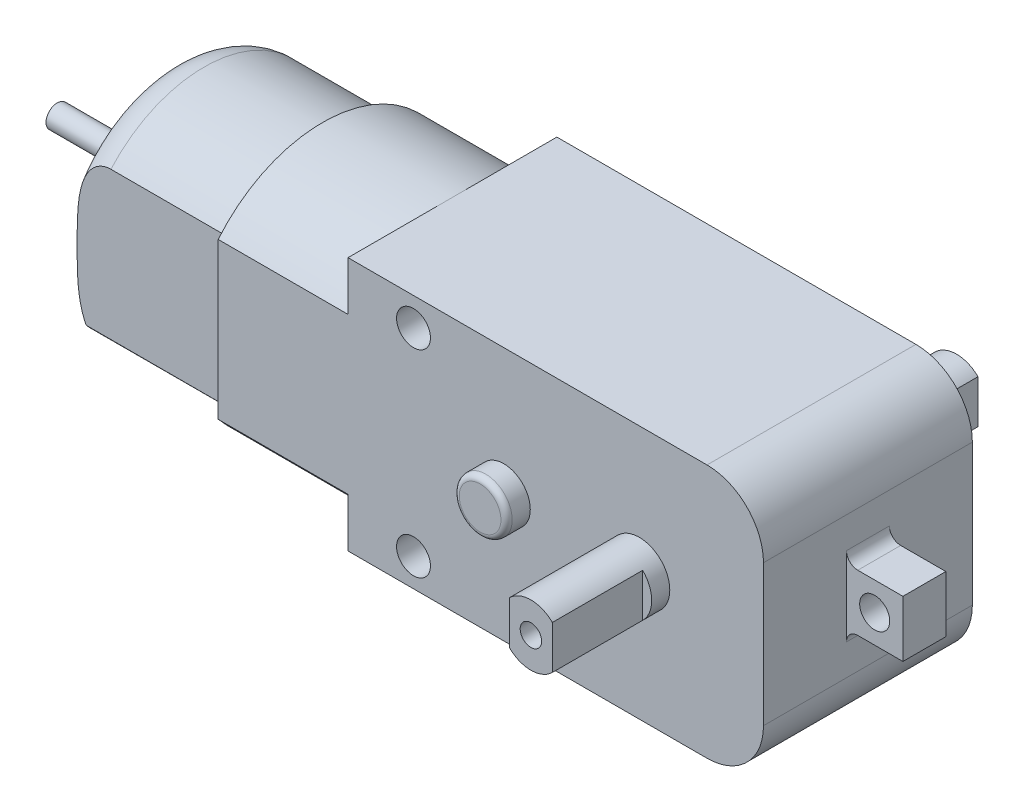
SolidWorks part; units mm, degrees
ref_plane "Plan de face" through (0, 0, 0) normal (0, 0, 1) x (1, 0, 0)
ref_plane "Plan de dessus" through (0, 0, 0) normal (0, 1, 0) x (1, 0, 0)
ref_plane "Plan de droite" through (0, 0, 0) normal (1, 0, 0) x (0, 0, -1)
sketch "Esquisse1" plane through (0, 0, 0) normal (0, 0, 1) x (1, 0, 0)
  line L0 (0, 0) -> (-18.8699, 0) construction
  line L1 (0, 11.25) -> (36.8, 11.25)
  line L2 (0, 11.25) -> (0, -11.25)
  line L3 (0, -11.25) -> (36.8, -11.25)
  line L4 (36.8, 11.25) -> (36.8, -11.25)
  dimension "D1" = 22.5
  dimension "D2" = 36.8
extrude "Boss.-Extru.1" add sketch "Esquisse1" along normal mid plane 18.5
fillet "Congé1" radius 5 2 edges at (36.8, -11.25, 0) (36.8, 11.25, 0)
sketch "Esquisse2" plane through (0, 0, 0) normal (-1, 0, 0) x (0, 0, 1)
  line L0 (-9.25, -6.9) -> (-9.25, 6.9)
  line L1 (-9.25, 11.25) -> (-9.25, -11.25) construction
  line L2 (-12.8447, 0) -> (12.3729, 0) construction
  line L3 (0, 0) -> (0, 4.8248) construction
  line L4 (9.25, -6.9) -> (9.25, 6.9)
  line L5 (9.25, 11.25) -> (-9.25, 11.25) construction
  line L6 (9.25, -11.25) -> (-9.25, -11.25) construction
  arc A0 (-9.25, 6.9) -> (9.25, 6.9) centre (0, -0.7598) cw
  arc A1 (-9.25, -6.9) -> (9.25, -6.9) centre (0, 0.7598) ccw
  point P8 (-9.25, 0)
  dimension "D1" = 13.8
extrude "Boss.-Extru.2" add sketch "Esquisse2" along normal blind 11.5
sketch "Esquisse3" plane through (-11.5, 0, 0) normal (-1, 0, 0) x (0, 0, 1)
  line L0 (-8.25, 6.5308) -> (-8.25, -6.5308)
  line L1 (8.25, -6.5308) -> (8.25, 6.5308)
  arc A0 (-8.25, -6.5308) -> (8.25, -6.5308) centre (0, 0.7598) ccw
  arc A1 (8.25, 6.5308) -> (-8.25, 6.5308) centre (0, -0.7598) ccw
extrude "Boss.-Extru.3" add sketch "Esquisse3" along normal blind 13.5
fillet "Congé2" radius 3 1 edges at (-25, 10.25, 0)
sketch "Esquisse4" plane through (-25, 0, 0) normal (-1, 0, 0) x (0, 0, 1)
  circle A0 centre (0, 0) radius 1
  dimension "D1" = 2
extrude "Boss.-Extru.4" add sketch "Esquisse4" along normal blind 10
sketch "Esquisse5" plane through (0, 0, 0) normal (0, 0, 1) x (1, 0, 0)
  line L0 (36.8, 0) -> (45.5564, 0) construction
  line L1 (36.8, -6.25) -> (36.8, 6.25) construction
  line L3 (36.8, 2.5) -> (41.8, 2.5)
  line L4 (36.8, 2.5) -> (36.8, -2.5)
  line L5 (36.8, -2.5) -> (41.8, -2.5)
  line L6 (41.8, 2.5) -> (41.8, -2.5)
  dimension "D1" = 5
  dimension "D2" = 5
extrude "Boss.-Extru.5" add sketch "Esquisse5" along normal mid plane 3.8
fillet "Congé3" radius 1 2 edges at (36.8, -2.5, 0) (36.8, 2.5, 0)
sketch "Esquisse6" plane through (0, 0, 1.9) normal (0, 0, 1) x (1, 0, 0)
  line L0 (41.8, 0) -> (36.8, 0) construction
  line L1 (41.8, -2.5) -> (41.8, 2.5) construction
  line L2 (36.8, -6.25) -> (36.8, 6.25) construction
  circle A0 centre (39.3, 0) radius 1.33
  dimension "D1" = 2.66
extrude "Enlèv. mat.-Extru.1" cut sketch "Esquisse6" against normal through all
sketch "Esquisse7" plane through (0, 0, 9.25) normal (0, 0, 1) x (1, 0, 0)
  line L0 (36.8, 0) -> (12.9382, 0) construction
  line L1 (36.8, -6.25) -> (36.8, 6.25) construction
  circle A0 centre (25.8, 0) radius 2.7
  dimension "D2" = 5.4
  dimension "D1" = 11
extrude "Boss.-Extru.6" add sketch "Esquisse7" along normal blind 9.6
sketch "Esquisse8" plane through (0, 0, 18.85) normal (0, 0, 1) x (1, 0, 0)
  line L0 (25.8, 0) -> (25.8, 5.8835) construction
  line L1 (23.9, 3.7002) -> (27.7, 3.7002)
  line L2 (23.9, 3.7002) -> (23.9, -3.6964)
  line L3 (23.9, -3.6964) -> (27.7, -3.6964)
  line L4 (27.7, 3.7002) -> (27.7, -3.6964)
  dimension "D1" = 3.8
extrude "Enlèv. mat.-Extru.2" cut sketch "Esquisse8" against normal blind 8 flip side to cut
sketch "Esquisse9" plane through (0, 0, 18.85) normal (0, 0, 1) x (1, 0, 0)
  circle A0 centre (25.8, 0) radius 0.95
  dimension "D1" = 1.9
extrude "Enlèv. mat.-Extru.3" cut sketch "Esquisse9" against normal blind 10
sketch "Esquisse10" plane through (0, 0, 9.25) normal (0, 0, 1) x (1, 0, 0)
  line L0 (0, 0) -> (49.7219, 0) construction
  line L1 (36.8, -6.25) -> (36.8, 6.25) construction
  circle A0 centre (5.8, 8.75) radius 1.5
  circle A1 centre (5.8, -8.75) radius 1.5
  dimension "D2" = 3
  dimension "D1" = 31
  dimension "D3" = 17.5
extrude "Enlèv. mat.-Extru.4" cut sketch "Esquisse10" against normal through all
mirror "Symétrie1" about plane through (0, 0, 0) normal (0, 0, 1) of "Enlèv. mat.-Extru.2", "Boss.-Extru.6", "Enlèv. mat.-Extru.3"
sketch "Esquisse11" plane through (0, 0, 9.25) normal (0, 0, 1) x (1, 0, 0)
  circle A0 centre (13.8, 0) radius 2.3449
  circle A1 centre (25.8, 0) radius 0.95 construction
  dimension "D2" = 4.6898
  dimension "D1" = 12
extrude "Boss.-Extru.7" add sketch "Esquisse11" along normal blind 2.1
fillet "Congé4" radius 0.5 1 edges at (16.1449, 0, 11.35)
